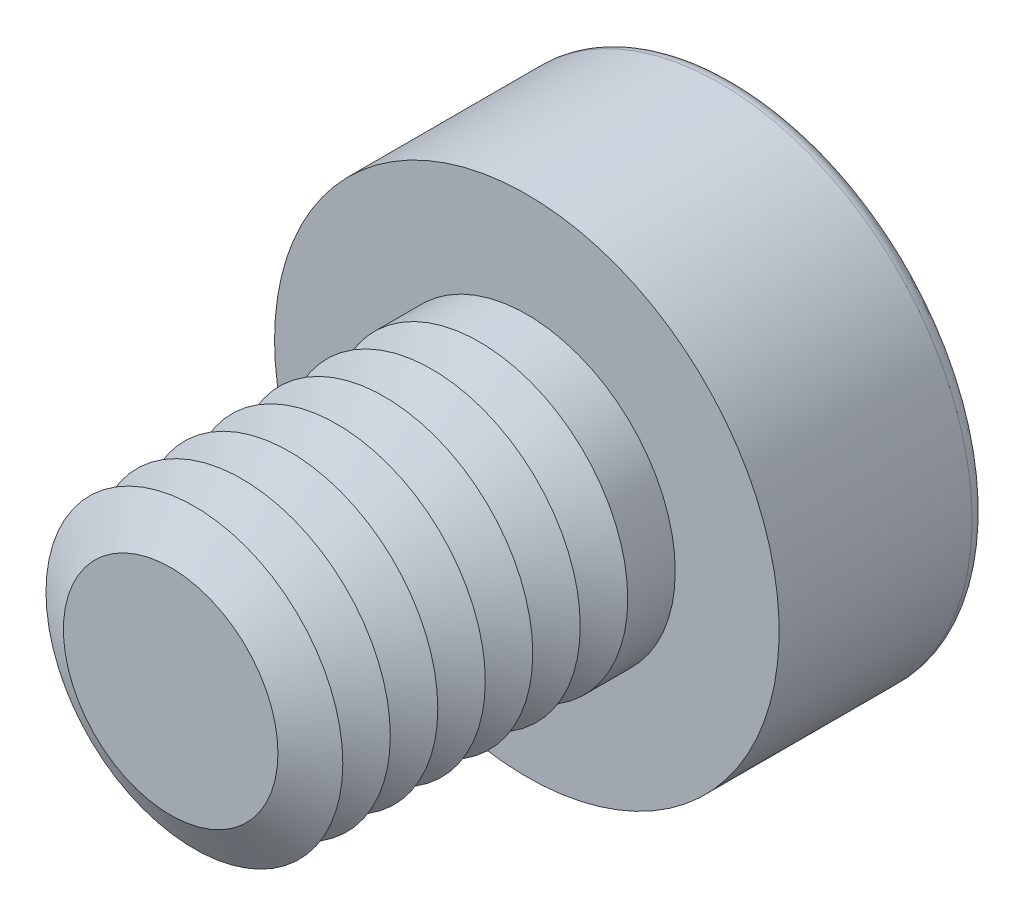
SolidWorks part; units mm, degrees
ref_plane "Front Plane" through (0, 0, 0) normal (0, 0, 1) x (1, 0, 0)
ref_plane "Top Plane" through (0, 0, 0) normal (0, 1, 0) x (1, 0, 0)
ref_plane "Right Plane" through (0, 0, 0) normal (1, 0, 0) x (0, 0, -1)
sketch "Sketch1" plane through (0, 0, 0) normal (0, 0, 1) x (1, 0, 0)
  circle A0 centre (0, 0) radius 2.5
  dimension "D1" = 5
extrude "Boss-Extrude1" add sketch "Sketch1" along normal blind 6
sketch "Sketch2" plane through (0, 0, 0) normal (0, 0, -1) x (-1, 0, 0)
  circle A0 centre (0, 0) radius 4.25
  dimension "D1" = 8.5
extrude "Boss-Extrude2" add sketch "Sketch2" along normal blind 3.5
sketch "Sketch3" plane through (0, 0, -3.5) normal (0, 0, -1) x (-1, 0, 0)
  line L1 (-0.866, 1.5) -> (-1.7321, 0)
  line L2 (-1.7321, 0) -> (-0.866, -1.5)
  line L3 (-0.866, -1.5) -> (0.866, -1.5)
  line L4 (0.866, -1.5) -> (1.7321, 0)
  line L5 (1.7321, 0) -> (0.866, 1.5)
  line L6 (0.866, 1.5) -> (-0.866, 1.5)
  circle A0 centre (0, 0) radius 1.5 construction
  dimension "D1" = 3
extrude "Cut-Extrude1" cut sketch "Sketch3" against normal blind 2.25
fillet "Fillet1" radius 0.25 1 edges at (-4.25, 0, -3.5)
sketch "Sketch4" plane through (0, 0, -1.25) normal (0, 0, -1) x (-1, 0, 0)
  line L0 (0.866, -1.5) -> (1.7321, 0) construction
  circle A0 centre (0, 0) radius 1.5
extrude "Cut-Extrude2" cut sketch "Sketch4" against normal through all draft 60
sketch "Sketch5" plane through (0, 0, -3.5) normal (0, 0, -1) x (-1, 0, 0)
  circle A0 centre (0, 0) radius 1.7321
extrude "Cut-Extrude3" cut sketch "Sketch5" against normal through all draft 75
sketch "Sketch7" plane through (0, 0, 0) normal (1, 0, 0) x (0, 0, -1)
  line L25 (-6, 1.8072) -> (-5.6, 2.5)
  line L26 (-6, 2.5) -> (-6, -2.5) construction
  line L27 (-5.6, 2.5) -> (-6.4, 2.5)
  line L28 (-6.4, 2.5) -> (-6, 1.8072)
  line L29 (0, 2.5) -> (-6, 2.5) construction
  dimension "D1" = 0.8
revolve "Cut-Revolve1" cut sketch "Sketch7" angle 360 about axis through (0, 0, 6) along (0, 0, -1)
pattern_linear "LPattern1" count 7 spacing 0.8 along (0, 0, -1) of "Cut-Revolve1"
